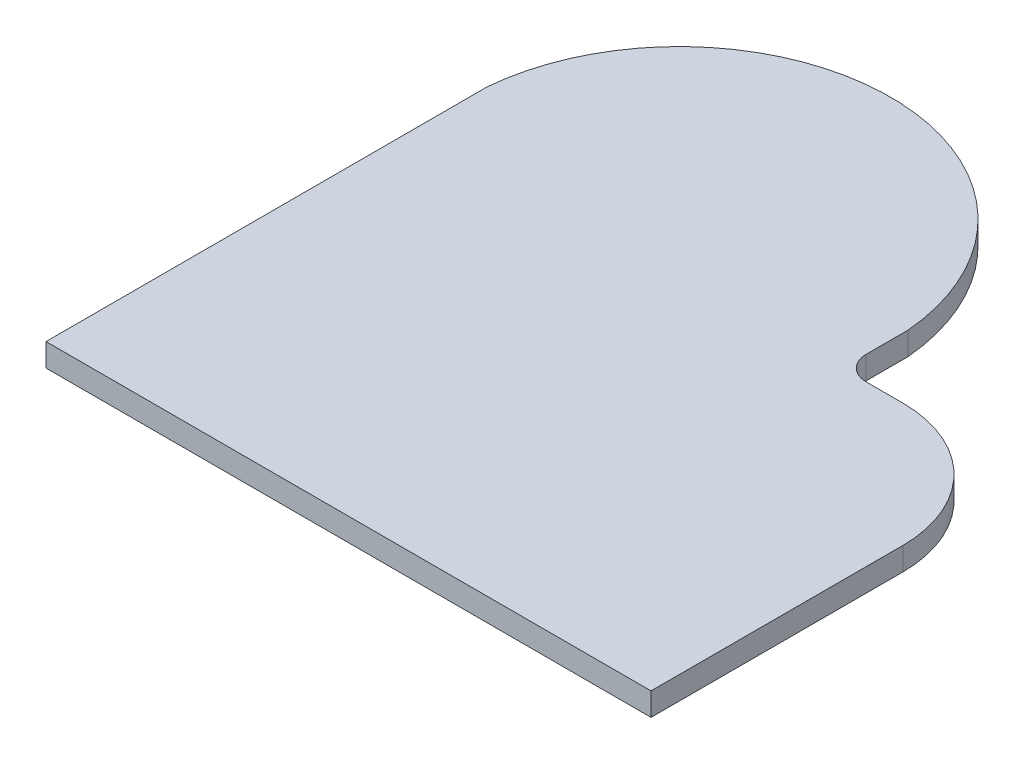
SolidWorks part; units mm, degrees
ref_plane "Front Plane" through (0, 0, 0) normal (0, 0, 1) x (1, 0, 0)
ref_plane "Top Plane" through (0, 0, 0) normal (0, 1, 0) x (1, 0, 0)
ref_plane "Right Plane" through (0, 0, 0) normal (1, 0, 0) x (0, 0, -1)
sketch "circuit outline" plane through (0, 0, 0) normal (0, 1, 0) x (1, 0, 0)
  line L0 (-69.85, 0) -> (-69.85, 15.875)
  line L1 (0, -31.75) -> (-69.85, -31.75)
  line L2 (0, -31.75) -> (0, 0)
  line L3 (0, 0) -> (-17.78, 0)
  line L4 (-69.85, -31.75) -> (-69.85, 0)
  line L5 (-25.4, 15.875) -> (-25.4, 7.62)
  arc A0 (-25.4, 15.875) -> (-69.85, 15.875) centre (-47.625, 15.875) ccw
  arc A1 (-17.78, 0) -> (-25.4, 7.62) centre (-17.78, 7.62) cw
  point P6 (-47.625, 38.1)
  dimension "D3" = 44.45
  dimension "D5" = 7.62
  dimension "D1" = 38.1
  dimension "D2" = 69.85
  dimension "D4" = 31.75
sketch "Sketch2" plane through (0, 0, 0) normal (0, 1, 0) x (1, 0, 0)
  line L0 (0, -31.75) -> (0, 0) construction
  line L1 (0, -31.75) -> (0, 0) construction
  line L2 (0, -31.75) -> (-69.85, -31.75) construction
  line L3 (-69.85, -31.75) -> (-69.85, 0) construction
  line L4 (-69.85, 0) -> (-69.85, 15.875) construction
  line L5 (-25.4, 15.875) -> (-25.4, 7.62) construction
  line L6 (0, 0) -> (-17.78, 0) construction
  line L7 (0, -31.75) -> (-69.85, -31.75) construction
  line L8 (-69.85, -31.75) -> (-69.85, 0) construction
  line L9 (-69.85, 0) -> (-69.85, 15.875) construction
  line L10 (-25.4, 15.875) -> (-25.4, 7.62) construction
  line L11 (0, 0) -> (-17.78, 0) construction
  line L12 (5.08, -36.83) -> (5.08, -10.16)
  line L13 (-10.16, 5.08) -> (-15.24, 5.08)
  line L14 (-20.32, 15.875) -> (-20.32, 10.16)
  line L15 (-74.93, 0) -> (-74.93, 15.875)
  line L16 (-74.93, -36.83) -> (-74.93, 0)
  line L17 (5.08, -36.83) -> (-74.93, -36.83)
  line L19 (-76.708, -38.608) -> (6.858, -38.608)
  line L20 (-76.708, -38.608) -> (-76.708, -44.958)
  line L21 (-18.542, 15.9538) -> (-18.542, 10.16)
  line L22 (-76.708, 0) -> (-76.708, 15.9538)
  line L23 (-76.708, -38.608) -> (-76.708, 0)
  line L24 (6.858, -38.608) -> (-76.708, -38.608)
  line L25 (6.858, -38.608) -> (6.858, -10.16)
  line L26 (-10.16, 6.858) -> (-15.24, 6.858)
  line L27 (-22.098, 14.7785) -> (-22.098, 9.0635)
  line L28 (-73.152, -1.0965) -> (-73.152, 14.7785)
  line L29 (-73.152, -36.1485) -> (-73.152, -1.0965)
  line L30 (3.302, -36.1485) -> (-73.152, -36.1485)
  line L31 (3.302, -36.1485) -> (3.302, -11.2565)
  line L32 (-10.16, 2.2055) -> (-15.24, 2.2055)
  line L33 (-76.708, -44.958) -> (6.858, -44.958)
  line L34 (6.858, -38.608) -> (6.858, -44.958)
  line L35 (-76.708, -44.958) -> (6.858, -44.958)
  line L36 (-76.708, -44.958) -> (-76.708, -46.736)
  line L37 (-76.708, -46.736) -> (6.858, -46.736)
  line L38 (6.858, -44.958) -> (6.858, -46.736)
  arc A0 (-25.4, 15.875) -> (-69.85, 15.875) centre (-47.625, 15.875) ccw construction
  arc A1 (-25.4, 7.62) -> (-17.78, 0) centre (-17.78, 7.62) ccw construction
  arc A2 (-25.4, 15.875) -> (-69.85, 15.875) centre (-47.625, 15.875) ccw construction
  arc A3 (-25.4, 7.62) -> (-17.78, 0) centre (-17.78, 7.62) ccw construction
  arc A5 (-20.32, 15.875) -> (-74.93, 15.875) centre (-47.625, 13.4126) ccw
  arc A6 (5.08, -10.16) -> (-10.16, 5.08) centre (-10.16, -10.16) ccw
  arc A8 (-15.24, 5.08) -> (-20.32, 10.16) centre (-15.24, 10.16) cw
  arc A9 (-15.24, 6.858) -> (-18.542, 10.16) centre (-15.24, 10.16) cw
  arc A10 (-18.542, 15.9538) -> (-76.708, 15.9538) centre (-47.625, 13.4126) ccw
  arc A11 (6.858, -10.16) -> (-10.16, 6.858) centre (-10.16, -10.16) ccw
  arc A12 (-15.24, 2.2055) -> (-22.098, 9.0635) centre (-15.24, 9.0635) cw
  arc A13 (-22.098, 14.7785) -> (-73.152, 14.7785) centre (-47.625, 13.335) ccw
  arc A14 (3.302, -11.2565) -> (-10.16, 2.2055) centre (-10.16, -11.2565) ccw
  dimension "D2" = 15.24
  dimension "D3" = 5.08
  dimension "D1" = 6.35
  dimension "D5" = 2.54
  dimension "D6" = 1.778
  dimension "D4" = 1.778
extrude "lid" add sketch "Sketch2" along normal blind 3.175 contours L34 L19 L20 L33 | L22 A10 L21 A9 L26 A11 L25 L24 L23
